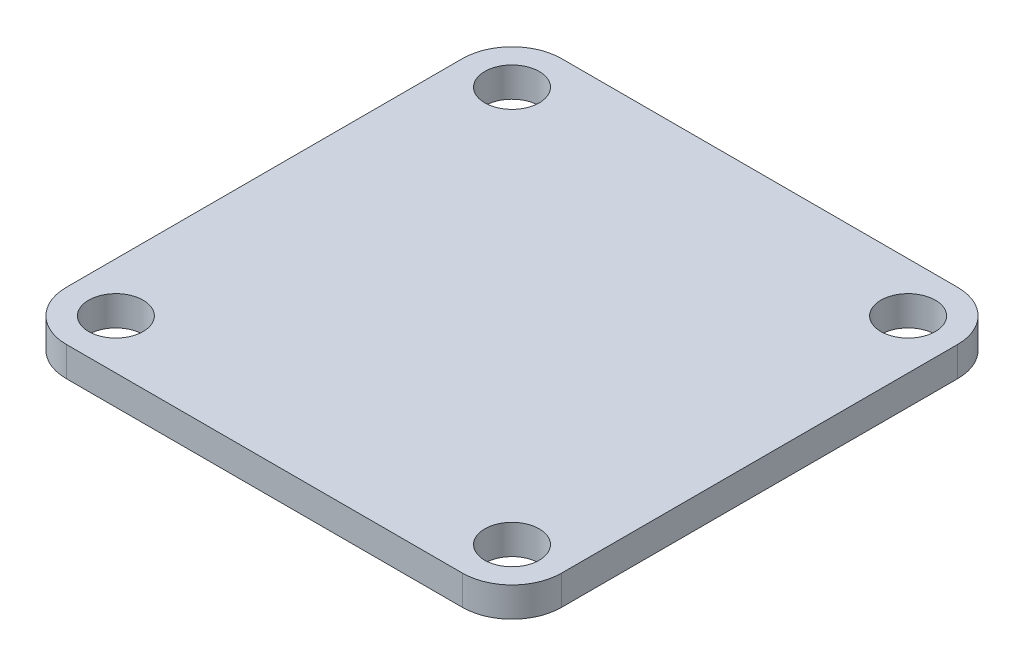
SolidWorks part; units mm, degrees
ref_plane "Front Plane" through (0, 0, 0) normal (0, 0, 1) x (1, 0, 0)
ref_plane "Top Plane" through (0, 0, 0) normal (0, 1, 0) x (1, 0, 0)
ref_plane "Right Plane" through (0, 0, 0) normal (1, 0, 0) x (0, 0, -1)
sketch "Sketch1" plane through (0, 0, 0) normal (0, 1, 0) x (1, 0, 0)
  line L1 (-20, 25) -> (20, 25)
  line L2 (-25, 20) -> (-25, -20)
  line L3 (-20, -25) -> (20, -25)
  line L4 (25, 20) -> (25, -20)
  arc A0 (-25, -20) -> (-20, -25) centre (-20, -20) ccw
  arc A1 (20, -25) -> (25, -20) centre (20, -20) ccw
  arc A2 (25, 20) -> (20, 25) centre (20, 20) ccw
  arc A3 (-20, 25) -> (-25, 20) centre (-20, 20) ccw
  circle A4 centre (-20, 20) radius 2.75
  circle A5 centre (20, 20) radius 2.75
  circle A6 centre (-20, -20) radius 2.75
  circle A7 centre (20, -20) radius 2.75
  point P6 (-25, -25)
  point P11 (25, 25)
  point P14 (-25, 25)
extrude "Boss-Extrude1" add sketch "Sketch1" along normal blind 3
equation "\"D5@Sketch1\"=\"D4@Sketch1\""
equation "\"D6@Sketch1\"=\"D4@Sketch1\""
equation "\"D7@Sketch1\"=\"D4@Sketch1\""
equation "\"D8@Sketch1\"=\"D2@Sketch1\"/2"
equation "\"D9@Sketch1\"=\"D2@Sketch1\"/2"
